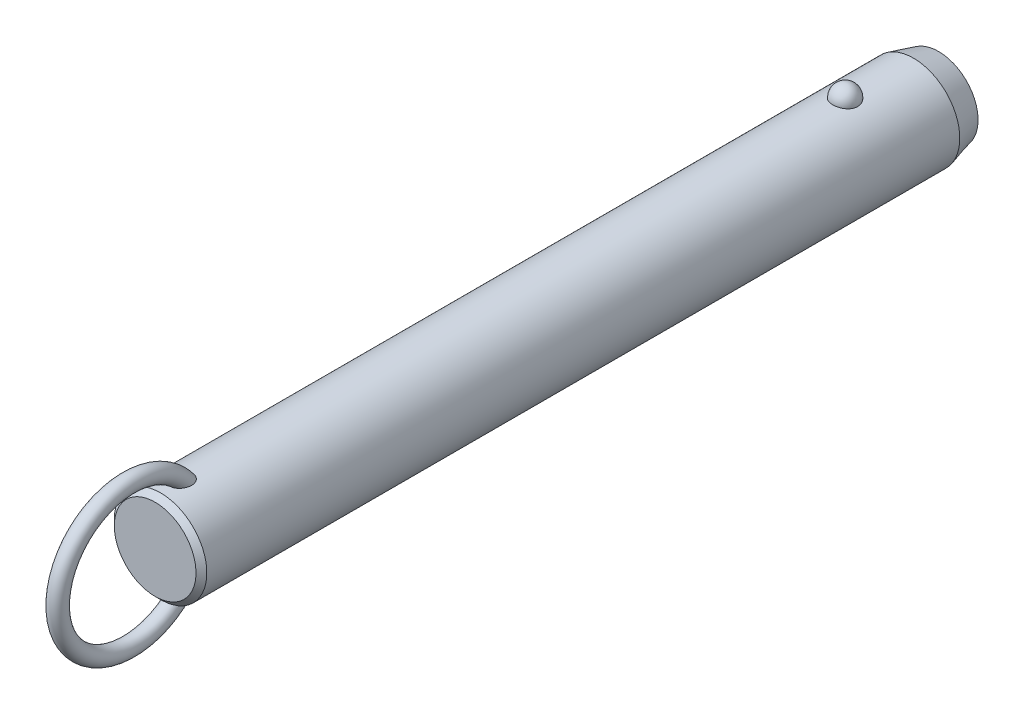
SolidWorks part; units mm, degrees
ref_plane "Front Plane" through (0, 0, 0) normal (0, 0, 1) x (1, 0, 0)
ref_plane "Top Plane" through (0, 0, 0) normal (0, 1, 0) x (1, 0, 0)
ref_plane "Right Plane" through (0, 0, 0) normal (1, 0, 0) x (0, 0, -1)
sketch "Sketch2" plane through (0, 0, 0) normal (0, 0, 1) x (1, 0, 0)
  circle A0 centre (0, 0) radius 11.1
  point P3 (0, 11.1)
  dimension "D1" = 22.2
extrude "Boss-Extrude1" add sketch "Sketch2" along normal blind 149.9
sketch "Sketch3" plane through (0, 0, 0) normal (0, 0, -1) x (-1, 0, 0)
  circle A0 centre (0, 0) radius 11.1
  dimension "D1" = 22.2
extrude "Boss-Extrude2" add sketch "Sketch3" along normal blind 25.4
chamfer "Chamfer1" distance 6 angle 15 1 edges at (-11.1, 0, -25.4)
sketch "Sketch12" plane through (0, 0, 0) normal (1, 0, 0) x (0, 0, -1)
  line L0 (-149.9, 11.1) -> (-149.9, -11.1) construction
  point P0 (-149.9, 0)
sketch "Sketch13" plane through (0, 0, 0) normal (1, 0, 0) x (0, 0, -1)
  circle A0 centre (-168.95, 0) radius 19.05
  point P2 (-149.9, 0)
  dimension "D1" = 38.1
sketch "Sketch14" plane through (0, 0, 0) normal (0, 1, 0) x (1, 0, 0)
  circle A0 centre (0, -151.9) radius 2
  point P2 (0, -149.9)
  dimension "D1" = 4
sweep "Sweep1" add profiles "Sketch14" path "Sketch13"
sketch "Sketch15" plane through (0, 0, 149.9) normal (0, 0, 1) x (1, 0, 0)
  circle A0 centre (0, 0) radius 11.1
  dimension "D1" = 22.2
extrude "Boss-Extrude3" add sketch "Sketch15" along normal blind 12.7
chamfer "Chamfer2" distance 1.3 angle 45 1 edges at (11.1, 0, 162.6)
sketch "Sketch18" plane through (0, 0, 0) normal (1, 0, 0) x (0, 0, -1)
  line L0 (19.4, 11.1) -> (-153.468, 11.1) construction
  line L1 (3, 14.1) -> (3, 8.1)
  line L2 (-153.468, -11.1) -> (19.4, -11.1) construction
  arc A0 (3, 14.1) -> (3, 8.1) centre (3, 11.1) ccw
  point P4 (0, 11.1)
  dimension "D1" = 25.2
revolve "Revolve1" add sketch "Sketch18" angle 360 about L1
